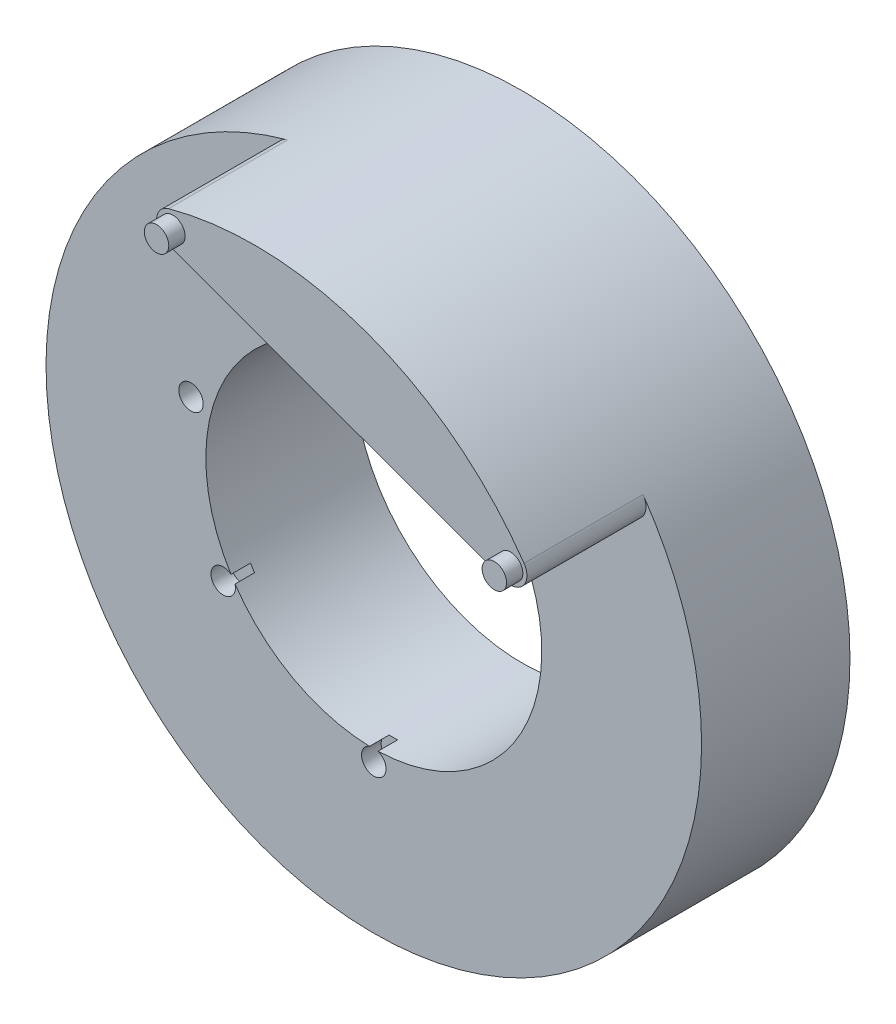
SolidWorks part; units mm, degrees
ref_plane "Face" through (0, 0, 0) normal (0, 0, 1) x (1, 0, 0)
ref_plane "Dessus" through (0, 0, 0) normal (0, 1, 0) x (1, 0, 0)
ref_plane "Droite" through (0, 0, 0) normal (1, 0, 0) x (0, 0, -1)
sketch "Esquisse1" plane through (0, 0, 0) normal (0, 0, 1) x (1, 0, 0)
  circle A0 centre (0, 11) radius 20.1 construction
  circle A1 centre (0, 11) radius 20.1
  circle A2 centre (0, 11) radius 10.3
  arc A4 (9.8979, 8.15) -> (9.8979, 13.85) centre (0, 11) ccw construction
extrude "Boss.-Extru.1" add sketch "Esquisse1" along normal offset from surface (9.1 mm away) 0.8
sketch "Esquisse2" plane through (0, 0, 9.1) normal (0, 0, 1) x (1, 0, 0)
  line L0 (-7.9882, 29.4445) -> (17.9752, 19.9946)
  line L1 (0, 11) -> (25.5039, 11) construction
  circle A0 centre (0, 11) radius 20.1 construction
  arc A1 (17.9752, 19.9946) -> (-7.9882, 29.4445) centre (0, 11) ccw
  point P5 (6.8746, 29.8878)
  dimension "D1" = 20
  dimension "D2" = 5.5
extrude "Boss.-Extru.2" add sketch "Esquisse2" along normal offset from surface (7.3 mm away) 1.8
fillet "Congé1" radius 1 2 edges at (-7.9882, 29.4445, 12.75) (17.9752, 19.9946, 12.75)
sketch "Esquisse3" plane through (0, 0, 16.4) normal (0, 0, 1) x (1, 0, 0)
  circle A1 centre (-5.0203, 29.4284) radius 0.75
  circle A2 centre (15.6913, 21.89) radius 0.75
  dimension "D1" = 1.5
extrude "Boss.-Extru.3" add sketch "Esquisse3" along normal offset from surface (1 mm away) 0.8
sketch "Esquisse4" plane through (0, 0, 9.1) normal (0, 0, 1) x (1, 0, 0)
  circle A0 centre (-11.2076, 13.7807) radius 0.75
  circle A1 centre (-9.2331, 5) radius 0.75
  circle A2 centre (0, 0) radius 0.75
  dimension "D1" = 1.5
extrude "Enlèv. mat.-Extru.1" cut sketch "Esquisse4" against normal blind 1.2
